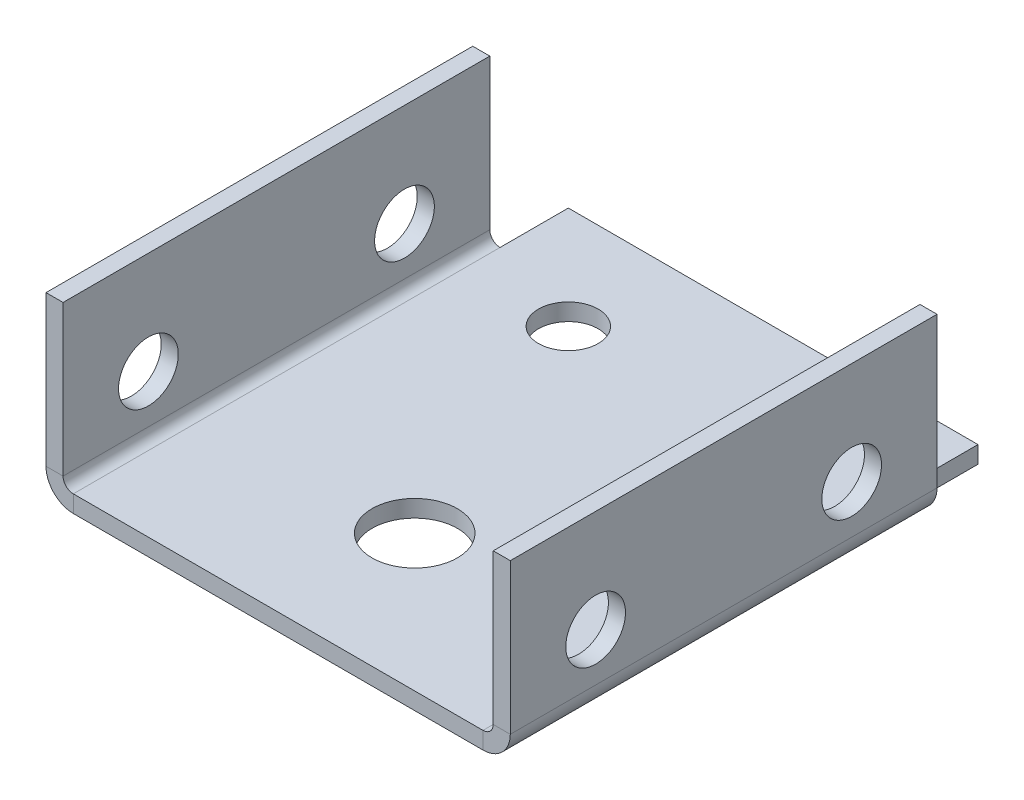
SolidWorks part; units mm, degrees
ref_plane "Front" through (0, 0, 0) normal (0, 0, 1) x (1, 0, 0)
ref_plane "Top" through (0, 0, 0) normal (0, 1, 0) x (1, 0, 0)
ref_plane "Right" through (0, 0, 0) normal (1, 0, 0) x (0, 0, -1)
sketch "Sketch1" plane through (0, 0, 0) normal (0, 1, 0) x (1, 0, 0)
  line L0 (36, 25) -> (48, 25)
  line L1 (0, 0) -> (48, 0)
  line L2 (0, 0) -> (0, 25)
  line L3 (0, 25) -> (12, 25)
  line L4 (48, 0) -> (48, 25)
  line L5 (0, 25) -> (48, 25) construction
  line L6 (12, 29) -> (36, 29)
  line L7 (24, 29) -> (24, 0) construction
  line L12 (12, 29) -> (12, 25)
  line L13 (36, 29) -> (36, 25)
  line L16 (0, 29) -> (48, 29) construction
  circle A0 centre (18, 23) radius 1.75
  circle A1 centre (30, 23) radius 1.75
  circle A2 centre (24, 8) radius 2.5
  circle A3 centre (6, 20) radius 1.75
  circle A4 centre (6, 5) radius 1.75
  circle A5 centre (42, 20) radius 1.75
  circle A6 centre (42, 5) radius 1.75
  dimension "D1" = 24
  dimension "D4" = 6
  dimension "D5" = 6
  dimension "D6" = 6
  dimension "D7" = 6
  dimension "D8" = 12
  dimension "D9" = 6
  dimension "D10" = 5
  dimension "D11" = 3.5
  dimension "D12" = 8
  dimension "D13" = 5
  dimension "D14" = 15
  dimension "D15" = 5
  dimension "D16" = 15
  dimension "D17" = 6
  dimension "D18" = 6
  dimension "D19" = 24
  dimension "D2" = 12
  dimension "D3" = 48
  dimension "D20" = 25
  dimension "D21" = 29
sheet metal parameters "Sheet-Metal1" thickness 1 parameters "D1"=0
base flange "Base-Flange1" sketch "Sketch1" thickness 1 reverse thickness direction yes parameters "D1"=0
sketch "Sketch3" plane through (0, 1, 0) normal (0, 1, 0) x (-1, 0, 0)
  line L3 (-12, -25) -> (-12, 0)
  line L4 (0, 0) -> (-48, 0) construction
  line L5 (-36, -25) -> (-36, 0)
sketched bend "Sketched Bend1" parameters "D1"=0.6
bend "SketchBend2" bend radius 0.6 bend angle 90 parameters "D5"=1
bend "SketchBend3" bend radius 0.6 bend angle 90 parameters "D5"=2
flat pattern "Flat-Pattern1"
sketch "Bend-Lines1" plane through (0, 0, 0) normal (0, 1, 0) x (-1, 0, 0)
bend of the flat pattern "Flatten-<SketchBend2>1"
bend of the flat pattern "Flatten-<SketchBend3>1"
